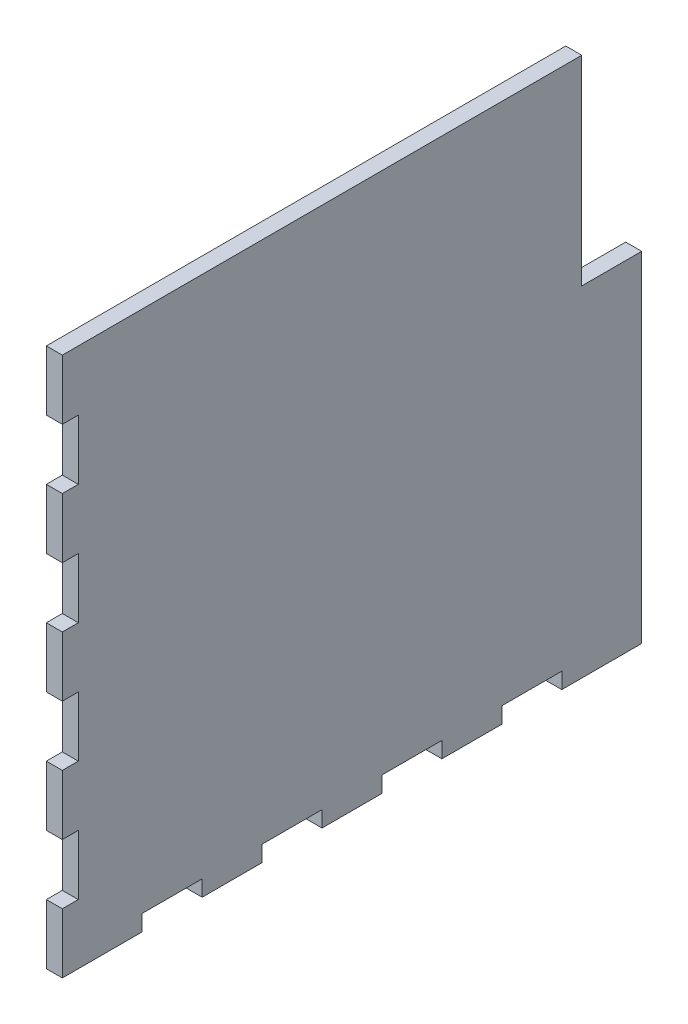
SolidWorks part; units mm, degrees
ref_plane "Alzado" through (0, 0, 0) normal (0, 0, 1) x (1, 0, 0)
ref_plane "Planta" through (0, 0, 0) normal (0, 1, 0) x (1, 0, 0)
ref_plane "Vista lateral" through (0, 0, 0) normal (1, 0, 0) x (0, 0, -1)
sketch "Sketch1" plane through (0, 0, 0) normal (1, 0, 0) x (0, 0, -1)
  line L0 (0, 0) -> (0, 135)
  line L1 (0, 135) -> (130, 135)
  line L2 (130, 135) -> (130, 85)
  line L3 (130, 85) -> (145, 85)
  line L4 (145, 85) -> (145, 0)
  line L5 (145, 0) -> (0, 0)
  dimension "D1" = 85
  dimension "D2" = 15
  dimension "D3" = 130
  dimension "D4" = 50
extrude "Boss-Extrude1" add sketch "Sketch1" along normal blind 4 contours L4 L5 L0 L1 L2 L3
sketch "Sketch2" plane through (4, 0, 0) normal (1, 0, 0) x (0, 0, -1)
  line L0 (145, 0) -> (0, 0) construction
  line L1 (20, 0) -> (35, 0)
  line L2 (20, 0) -> (20, 4)
  line L3 (20, 4) -> (35, 4)
  line L4 (35, 0) -> (35, 4)
  line L5 (0, 0) -> (0, 135) construction
  line L6 (50, 0) -> (65, 0)
  line L7 (50, 0) -> (50, 4)
  line L8 (50, 4) -> (65, 4)
  line L9 (65, 0) -> (65, 4)
  line L10 (110, 0) -> (125, 0)
  line L11 (110, 0) -> (110, 4)
  line L12 (110, 4) -> (125, 4)
  line L13 (125, 0) -> (125, 4)
  line L14 (80, 0) -> (95, 0)
  line L15 (80, 0) -> (80, 4)
  line L16 (80, 4) -> (95, 4)
  line L17 (95, 0) -> (95, 4)
  line L18 (145, 85) -> (145, 0) construction
  point P12 (0, 0)
  point P21 (0, 0)
  point P22 (0, 0)
  dimension "D1" = 15
  dimension "D2" = 4
  dimension "D3" = 20
  dimension "D4" = 15
  dimension "D5" = 4
  dimension "D6" = 15
  dimension "D7" = 15
  dimension "D8" = 15
  dimension "D9" = 4
  dimension "D10" = 4
  dimension "D11" = 20
  dimension "D12" = 15
extrude "Cut-Extrude1" cut sketch "Sketch2" against normal through all both and the other way through all
sketch "Sketch3" plane through (4, 0, 0) normal (1, 0, 0) x (0, 0, -1)
  line L0 (0, 0) -> (0, 135) construction
  line L1 (0, 120) -> (4, 120)
  line L2 (0, 120) -> (0, 105)
  line L3 (0, 105) -> (4, 105)
  line L4 (4, 120) -> (4, 105)
  line L5 (0, 135) -> (130, 135) construction
  line L6 (0, 90) -> (4, 90)
  line L7 (0, 90) -> (0, 75)
  line L8 (0, 75) -> (4, 75)
  line L9 (4, 90) -> (4, 75)
  line L10 (0, 60) -> (4, 60)
  line L11 (0, 60) -> (0, 45)
  line L12 (0, 45) -> (4, 45)
  line L13 (4, 60) -> (4, 45)
  line L14 (0, 30) -> (4, 30)
  line L15 (0, 30) -> (0, 15)
  line L16 (0, 15) -> (4, 15)
  line L17 (4, 30) -> (4, 15)
  line L18 (20, 0) -> (0, 0) construction
  point P20 (0, 0)
  point P21 (0, 0)
  point P22 (0, 0)
  dimension "D1" = 4
  dimension "D2" = 15
  dimension "D3" = 15
  dimension "D4" = 15
  dimension "D5" = 4
  dimension "D6" = 15
  dimension "D7" = 4
  dimension "D8" = 15
  dimension "D9" = 15
  dimension "D10" = 4
  dimension "D11" = 15
  dimension "D12" = 15
extrude "Cut-Extrude2" cut sketch "Sketch3" against normal through all both and the other way through all
